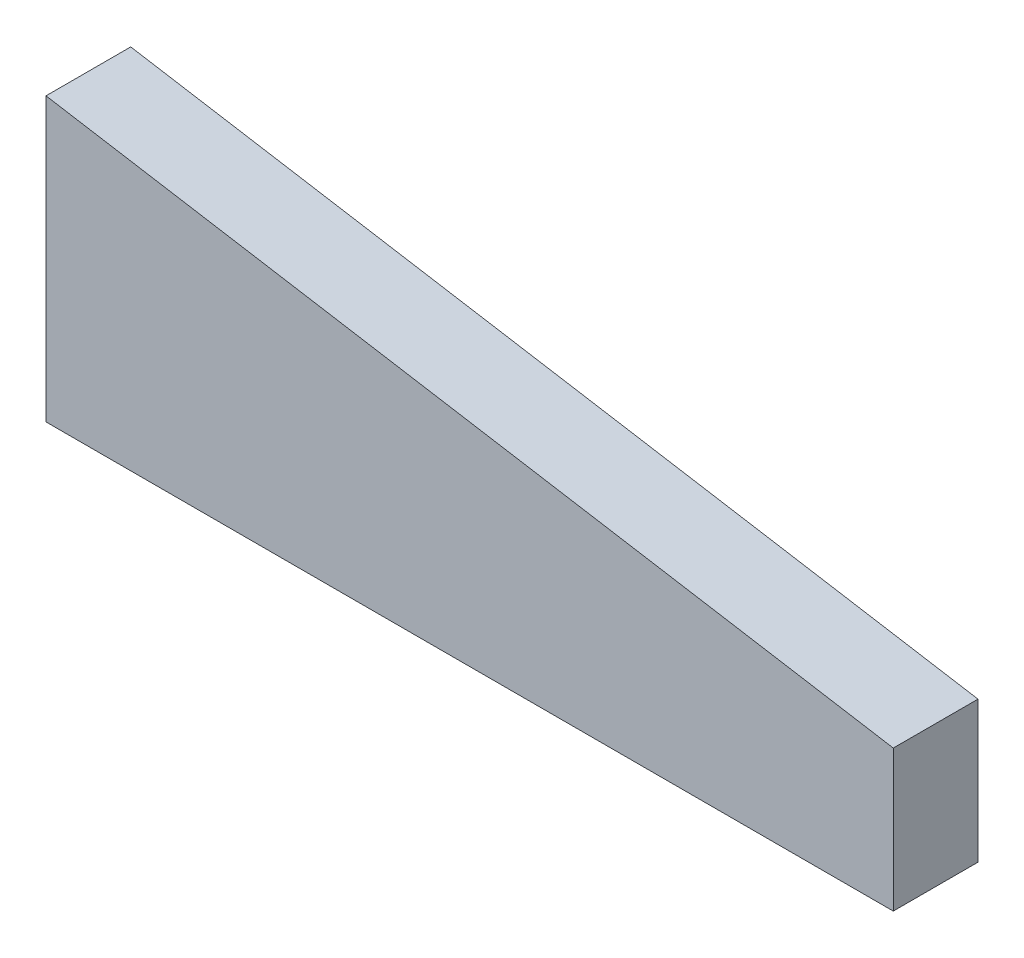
SolidWorks part; units mm, degrees
ref_plane "Plan de face" through (0, 0, 0) normal (0, 0, 1) x (1, 0, 0)
ref_plane "Plan de dessus" through (0, 0, 0) normal (0, 1, 0) x (1, 0, 0)
ref_plane "Plan de droite" through (0, 0, 0) normal (1, 0, 0) x (0, 0, -1)
sketch "Esquisse1" plane through (0, 0, 0) normal (0, 0, 1) x (1, 0, 0)
  line L0 (15, 0) -> (-15, 5)
  line L1 (-15, -5) -> (15, -5)
  line L2 (-15, -5) -> (-15, 5)
  line L4 (15, -5) -> (15, 0)
  line L5 (-15, -5) -> (15, 5) construction
  line L6 (-15, 5) -> (15, -5) construction
  point P0 (0, 0)
  dimension "D1" = 30
  dimension "D2" = 10
extrude "Boss.-Extru.1" add sketch "Esquisse1" along normal blind 3
